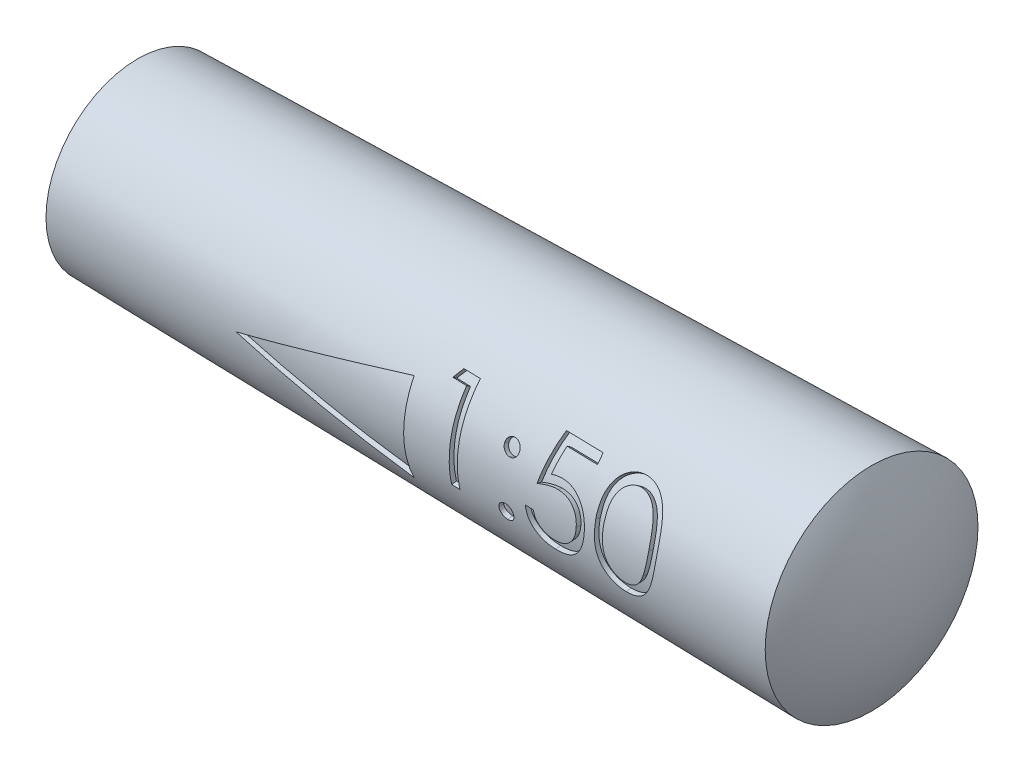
SolidWorks part; units mm, degrees
ref_plane "Front Plane" through (0, 0, 0) normal (0, 0, 1) x (1, 0, 0)
ref_plane "Top Plane" through (0, 0, 0) normal (0, 1, 0) x (1, 0, 0)
ref_plane "Right Plane" through (0, 0, 0) normal (1, 0, 0) x (0, 0, -1)
sketch "Sketch1" plane through (0, 0, 0) normal (1, 0, 0) x (0, 0, -1)
  circle A0 centre (0, 0) radius 1
  dimension "D1" = 2
extrude "Extrude1" add sketch "Sketch1" along normal mid plane 8
draft "Draft1" type of draft neutral plane draft angle 1.146 faces to draft 1 parameters "D1"=1.146
sketch "Sketch2" plane through (0, 0, 0) normal (0, 0, 1) x (1, 0, 0)
  line L0 (-4, 0) -> (-4, 1)
  line L1 (-4, 1) -> (-4, -1) construction
  line L2 (-4, 0) -> (-4.3, 0)
  line L3 (-4.3, 0) -> (-4.3, -1.08) construction
  line L4 (4, 0) -> (4, 1.16)
  line L5 (4, -1.16) -> (4, 1.16) construction
  line L6 (4, 0) -> (4.3, 0)
  line L7 (4.3, 0) -> (4.3, -1.08) construction
  line L8 (-4, -1) -> (4, -1.16) construction
  arc A0 (-4.3, 0) -> (-4, 1) centre (-2.4833, 0) cw
  arc A1 (4.3, 0) -> (4, 1.16) centre (1.9073, 0) ccw
  point P14 (0, -1.08)
revolve "Revolve1" add sketch "Sketch2" angle 360 about L2
sketch "Sketch5" plane through (0, 0, 0) normal (0, 0, 1) x (1, 0, 0)
  line L0 (0, 1.08) -> (0, -1.08) construction
  line L1 (4, 1.16) -> (-4, 1) construction
  line L2 (-4, -1) -> (4, -1.16) construction
ref_plane "Plane2" through (0, 0, 0) normal (-0.02, 0, 0.9998) x (0.9998, 0, 0.02)
sketch "Sketch6" plane through (0, 0, 0) normal (-0.02, 0, 0.9998) x (0.9998, 0, 0.02)
  line L0 (0, 0) -> (0, 0.5)
  line L1 (0, 1.08) -> (0, -1.08) construction
  line L2 (0, 0.5) -> (-1.866, 0)
  line L3 (-1.866, 0) -> (0, -0.5)
  line L4 (0, -0.5) -> (0, 0)
  line L5 (0, -0.25) -> (3, -0.25) construction
  text T0 "1:50" font "Century Gothic" height 1
  dimension "D1" = 1
  dimension "D2" = 30
  dimension "D3" = 3
wrap "Wrap2" sketch "Sketch6" wrap type deboss source sketch "Sketch6" thickness 0.05 parameters "D1"=0.05
equation "\"D2@Sketch2\" = \"D1@Sketch2\""
